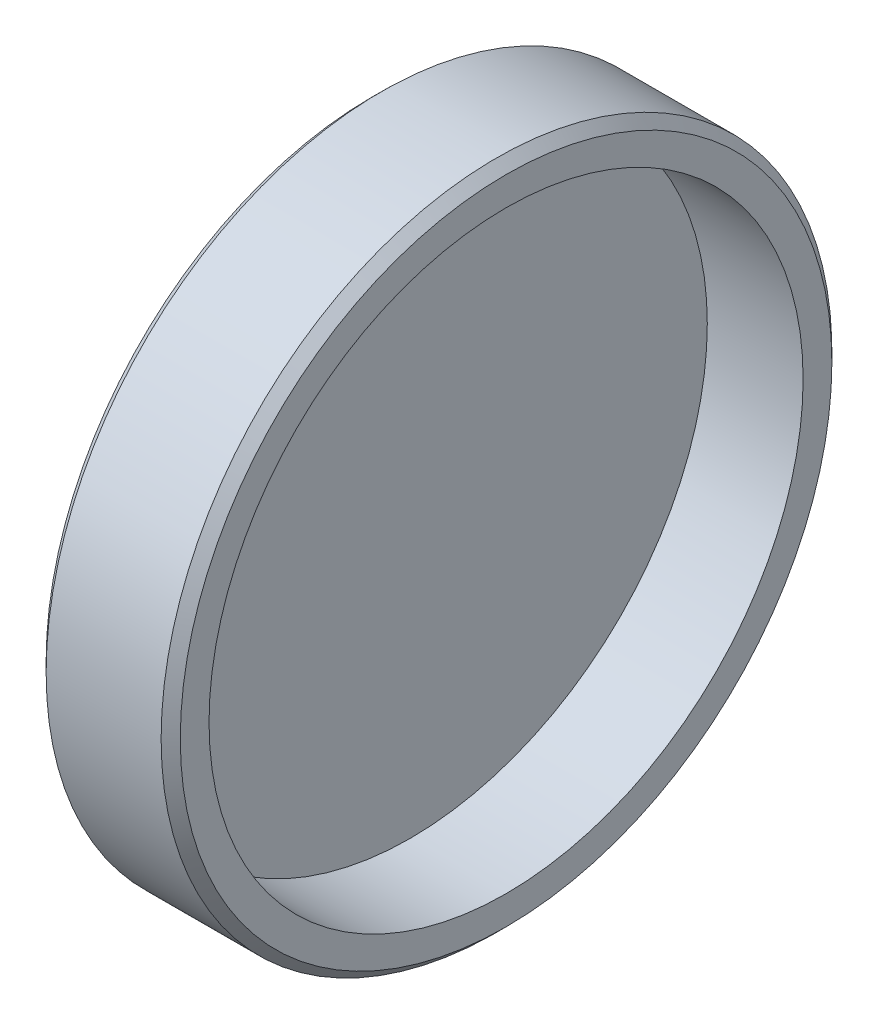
SolidWorks part; units mm, degrees
ref_plane "Face" through (0, 0, 0) normal (0, 0, 1) x (1, 0, 0)
ref_plane "Dessus" through (0, 0, 0) normal (0, 1, 0) x (1, 0, 0)
ref_plane "Droite" through (0, 0, 0) normal (1, 0, 0) x (0, 0, -1)
sketch "Esquisse1" plane through (0, 0, 0) normal (0, 0, 1) x (1, 0, 0)
  line L0 (0, 0) -> (5.7654, 0) construction
  line L1 (0, 0) -> (2, 0)
  line L2 (0, 0) -> (0, 17.5)
  line L3 (0, 17.5) -> (7, 17.5)
  line L4 (7, 15.5) -> (7, 17.5)
  line L5 (2, 15.5) -> (7, 15.5)
  line L6 (2, 15.5) -> (2, 0)
  dimension "D1" = 2
  dimension "D2" = 17.5
  dimension "D3" = 2
  dimension "D4" = 7
revolve "Base-Révolution" add sketch "Esquisse1" angle 360 about L0
chamfer "Chanfrein1" distance 0.5 angle 45
